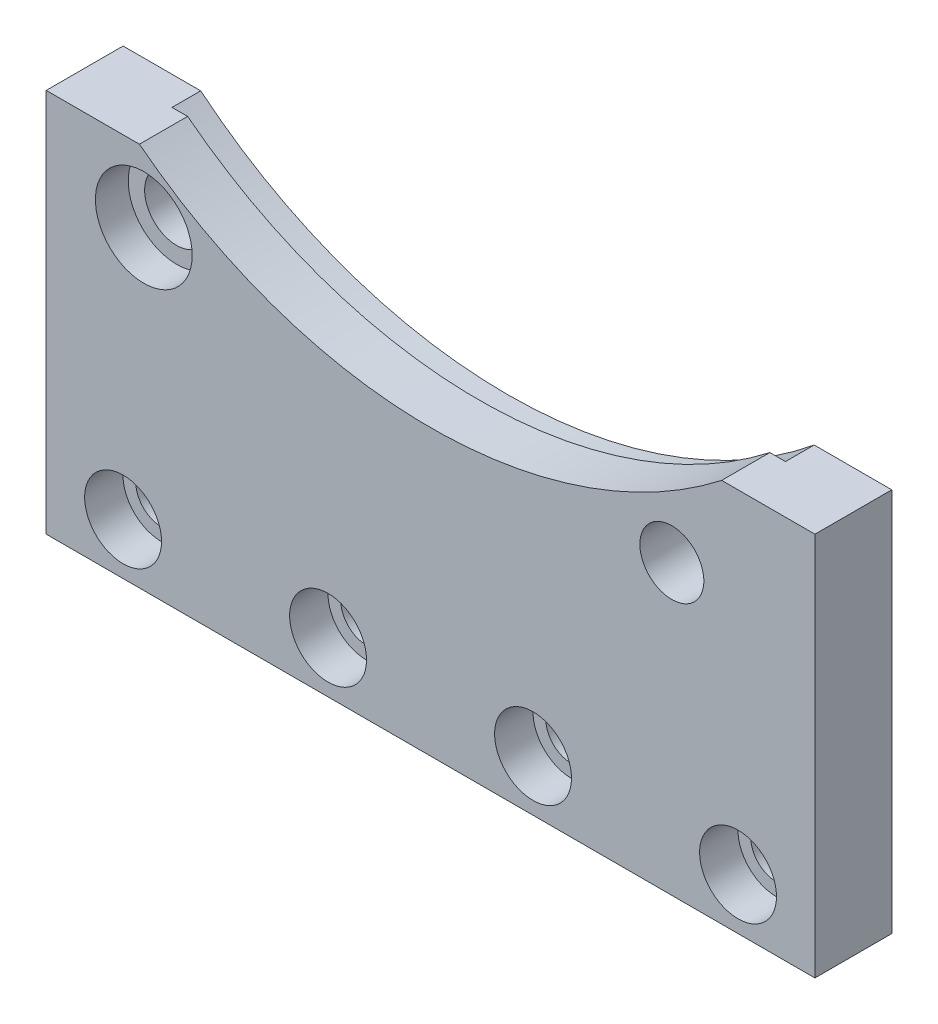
SolidWorks part; units mm, degrees
ref_plane "Front Plane" through (0, 0, 0) normal (0, 0, 1) x (1, 0, 0)
ref_plane "Top Plane" through (0, 0, 0) normal (0, 1, 0) x (1, 0, 0)
ref_plane "Right Plane" through (0, 0, 0) normal (1, 0, 0) x (0, 0, -1)
sketch "Sketch1" plane through (0, 0, 0) normal (0, 0, 1) x (1, 0, 0)
  line L0 (0, 0) -> (0, 6.35) construction
  line L1 (0, 0) -> (47.625, 0)
  line L2 (47.625, 0) -> (47.625, 47.625)
  line L3 (47.625, 47.625) -> (-47.625, 47.625)
  line L4 (-47.625, 47.625) -> (-47.625, 0)
  line L5 (-47.625, 0) -> (0, 0)
  line L6 (-38.1, 6.35) -> (-12.7, 6.35) construction
  line L7 (-12.7, 6.35) -> (12.7, 6.35) construction
  line L8 (12.7, 6.35) -> (38.1, 6.35) construction
  circle A0 centre (-12.7, 6.35) radius 3.175
  circle A1 centre (-38.1, 6.35) radius 3.175
  circle A2 centre (12.7, 6.35) radius 3.175
  circle A3 centre (38.1, 6.35) radius 3.175
  circle A4 centre (29.8958, 35.7124) radius 3.9624
  circle A5 centre (-35.5346, 38.9636) radius 3.9624
  circle A6 centre (-38.1, 6.35) radius 4.7625
  circle A7 centre (-12.7, 6.35) radius 4.7625
  circle A8 centre (12.7, 6.35) radius 4.7625
  circle A9 centre (38.1, 6.35) radius 4.7625
  circle A10 centre (-35.5346, 38.9636) radius 5.9944
  dimension "D2" = 6.35
  dimension "D8" = 7.9248
  dimension "D11" = 9.525
  dimension "D14" = 11.9888
  dimension "D1" = 25.4
  dimension "D3" = 6.35
  dimension "D4" = 95.25
  dimension "D5" = 47.625
  dimension "D6" = 29.8958
  dimension "D7" = 29.3624
  dimension "D9" = 35.5346
  dimension "D10" = 32.6136
  dimension "D12" = 3.2512
  dimension "D13" = 35.7124
sketch "Sketch2" plane through (0, 0, 0) normal (0, 0, 1) x (1, 0, 0)
  line L0 (-47.625, 0) -> (0, 0) construction
  line L1 (0, 0) -> (47.625, 0) construction
  line L2 (47.625, 0) -> (47.625, 47.625) construction
  line L3 (47.625, 47.625) -> (-47.625, 47.625) construction
  line L4 (-47.625, 47.625) -> (-47.625, 0) construction
  line L5 (-47.625, 0) -> (0, 0)
  line L6 (0, 0) -> (47.625, 0)
  line L7 (47.625, 0) -> (47.625, 47.625)
  line L8 (47.625, 47.625) -> (-47.625, 47.625)
  line L9 (-47.625, 47.625) -> (-47.625, 0)
  circle A0 centre (-38.1, 6.35) radius 3.175 construction
  circle A1 centre (-12.7, 6.35) radius 3.175 construction
  circle A2 centre (12.7, 6.35) radius 3.175 construction
  circle A3 centre (38.1, 6.35) radius 3.175 construction
  circle A4 centre (29.8958, 35.7124) radius 3.9624 construction
  circle A5 centre (-35.5346, 38.9636) radius 3.9624 construction
  circle A6 centre (-38.1, 6.35) radius 3.175
  circle A7 centre (-12.7, 6.35) radius 3.175
  circle A8 centre (12.7, 6.35) radius 3.175
  circle A9 centre (38.1, 6.35) radius 3.175
  circle A10 centre (29.8958, 35.7124) radius 3.9624
  circle A11 centre (-35.5346, 38.9636) radius 3.9624
extrude "Boss-Extrude1" add sketch "Sketch2" along normal blind 9.525
sketch "Sketch3" plane through (0, 0, 0) normal (0, 0, 1) x (1, 0, 0)
  line L0 (-12.7, 6.35) -> (12.7, 6.35) construction
  circle A0 centre (0, 93.98) radius 59.944
  circle A1 centre (0, 93.98) radius 58.7375
  dimension "D2" = 119.888
  dimension "D3" = 117.475
  dimension "D1" = 87.63
  dimension "D4" = 93.98
sketch "Sketch4" plane through (0, 0, 0) normal (0, 0, 1) x (1, 0, 0)
  circle A0 centre (0, 93.98) radius 58.7375 construction
  circle A1 centre (0, 93.98) radius 58.7375
extrude "Cut-Extrude1" cut sketch "Sketch4" along normal blind 14.605
sketch "Sketch5" plane through (0, 0, 0) normal (0, 0, 1) x (1, 0, 0)
  circle A0 centre (-38.1, 6.35) radius 4.7625 construction
  circle A1 centre (-12.7, 6.35) radius 4.7625 construction
  circle A2 centre (12.7, 6.35) radius 4.7625 construction
  circle A3 centre (38.1, 6.35) radius 4.7625 construction
  circle A4 centre (-38.1, 6.35) radius 4.7625
  circle A5 centre (-12.7, 6.35) radius 4.7625
  circle A6 centre (12.7, 6.35) radius 4.7625
  circle A7 centre (38.1, 6.35) radius 4.7625
extrude "Cut-Extrude2" cut sketch "Sketch5" along normal blind 10.16 from offset 4.7752
sketch "Sketch6" plane through (0, 0, 0) normal (0, 0, 1) x (1, 0, 0)
  circle A0 centre (0, 93.98) radius 59.944 construction
  circle A1 centre (0, 93.98) radius 59.944
extrude "Cut-Extrude3" cut sketch "Sketch6" along normal blind 3.556
sketch "Sketch7" plane through (0, 0, 9.525) normal (0, 0, 1) x (1, 0, 0)
  circle A0 centre (-35.5346, 38.9636) radius 5.9944 construction
  circle A1 centre (-35.5346, 38.9636) radius 5.9944
extrude "Cut-Extrude4" cut sketch "Sketch7" against normal blind 4.064
